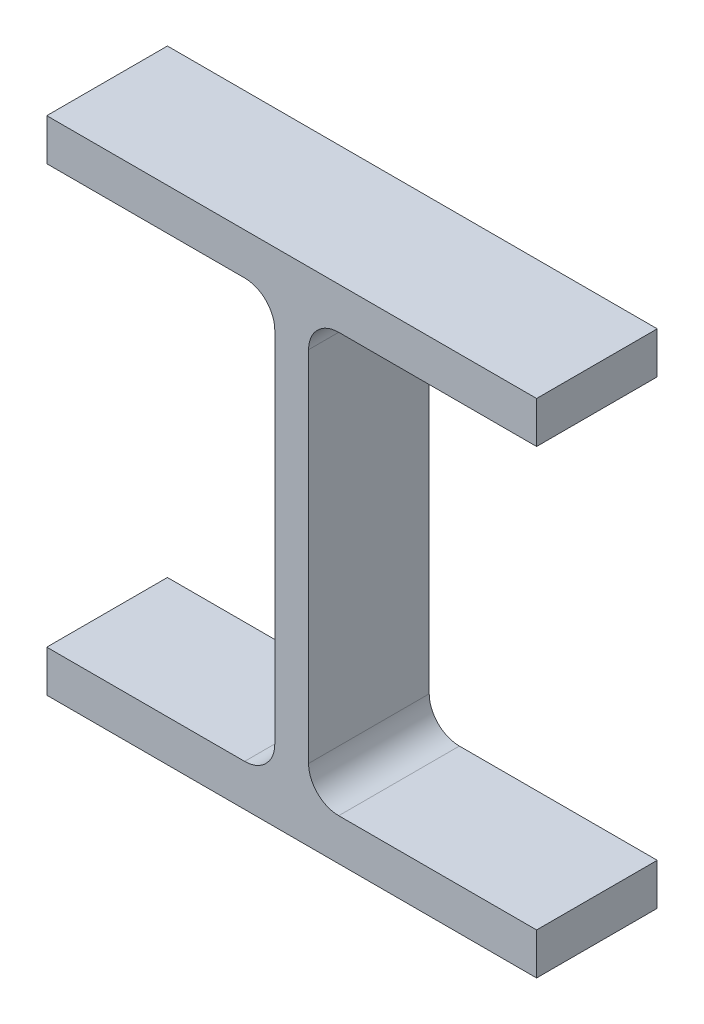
SolidWorks part; units mm, degrees
ref_plane "Plane1" through (0, 0, 0) normal (0, 0, 1) x (1, 0, 0)
ref_plane "Plane2" through (0, 0, 0) normal (0, 1, 0) x (1, 0, 0)
ref_plane "Plane3" through (0, 0, 0) normal (1, 0, 0) x (0, 0, -1)
sketch "Sketch1" plane through (0, 0, 0) normal (0, 0, 1) x (1, 0, 0)
  line L0 (0, 0) -> (0, 8.763)
  line L1 (0, 8.763) -> (41.656, 8.763)
  line L2 (48.006, 15.113) -> (48.006, 90.5509)
  line L3 (41.656, 96.9009) -> (0, 96.9009)
  line L4 (0, 96.9009) -> (0, 105.6639)
  line L5 (0, 105.6639) -> (103.1239, 105.6639)
  line L6 (103.1239, 105.6639) -> (103.1239, 96.9009)
  line L7 (103.1239, 96.9009) -> (61.4679, 96.9009)
  line L8 (55.118, 90.5509) -> (55.118, 15.113)
  line L9 (61.4679, 8.763) -> (103.1239, 8.763)
  line L10 (103.1239, 8.763) -> (103.1239, 0)
  line L11 (103.1239, 0) -> (0, 0)
  line L12 (51.562, -72.1361) -> (51.562, 105.6639) construction
  arc A0 (41.656, 8.763) -> (48.006, 15.113) centre (41.656, 15.113) ccw
  arc A1 (48.006, 90.5509) -> (41.656, 96.9009) centre (41.656, 90.5509) ccw
  arc A2 (61.4679, 96.9009) -> (55.118, 90.5509) centre (61.4679, 90.5509) ccw
  arc A3 (55.118, 15.113) -> (61.4679, 8.763) centre (61.4679, 15.113) ccw
extrude "BaseSteelW" add sketch "Sketch1" against normal mid plane 25.4
equation "\"D1@Sketch1\" = \"Tw@Sketch1\" / 2"
equation "\"D2@Sketch1\" = \"Tf@Sketch1\""
